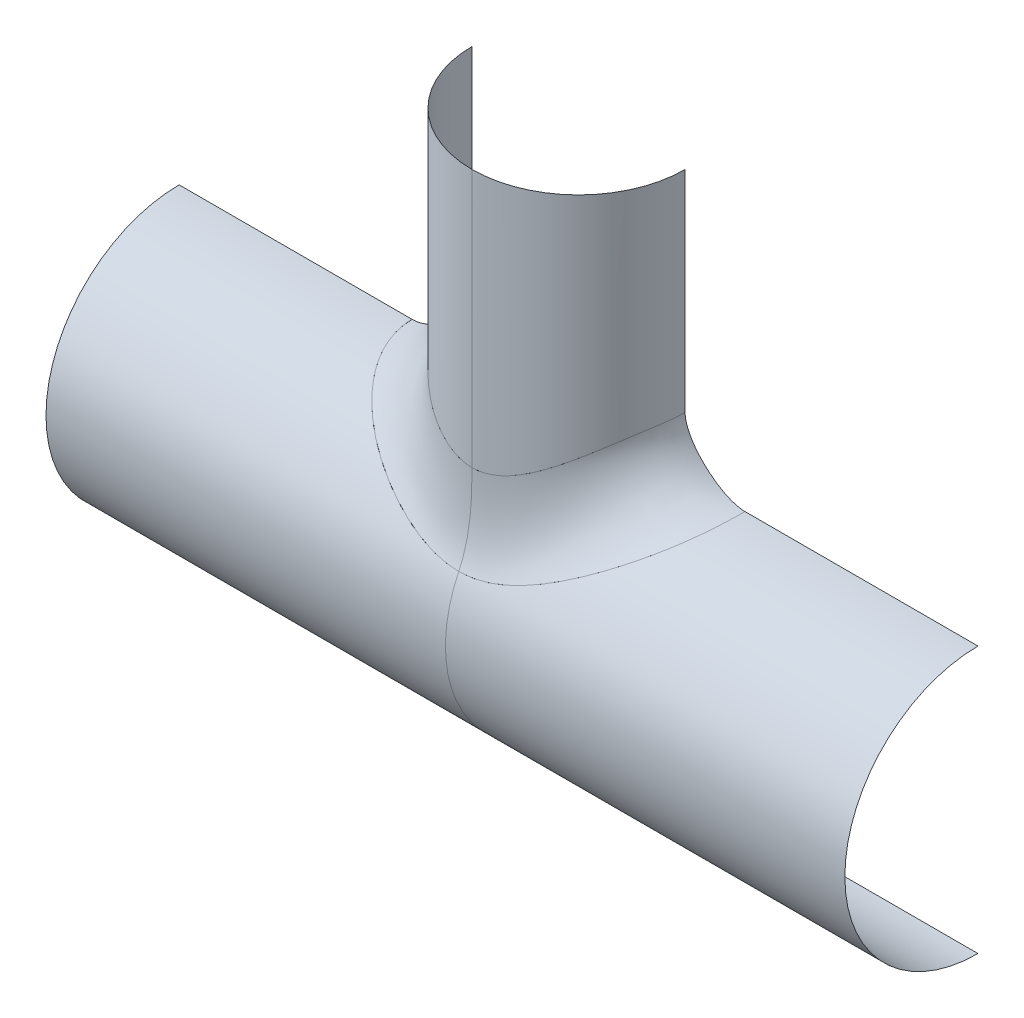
SolidWorks part; units mm, degrees
ref_plane "Vorne" through (0, 0, 0) normal (0, 0, 1) x (1, 0, 0)
ref_plane "Oben" through (0, 0, 0) normal (0, 1, 0) x (1, 0, 0)
ref_plane "Rechts" through (0, 0, 0) normal (1, 0, 0) x (0, 0, -1)
sketch "Skizze1" plane through (0, 0, 0) normal (1, 0, 0) x (0, 0, -1)
  circle A0 centre (0, 0) radius 50
  dimension "D1" = 100
surface "Oberfläche-Linear austragen1" sketch "Skizze1" parameters "D1"=300
sketch "Skizze3" plane through (0, 0, 0) normal (0, 1, 0) x (1, 0, 0)
  circle A0 centre (0, 0) radius 40
  dimension "D1" = 80
surface "Oberfläche-Linear austragen2" sketch "Skizze3" parameters "D1"=300
surface "Oberfläche-Trimmen1"
surface "Oberfläche-Trimmen2"
fillet "Verrundung2" radius 20 4 edges at (-10.3013, 31.7194, -38.6508)
sketch "Skizze4" plane through (0, 0, 0) normal (0, 0, 1) x (1, 0, 0)
  line L0 (-40, 150) -> (-40, 70) construction
  line L1 (54.177, 71) -> (25.702, 71) construction
  line L2 (-25.2896, 71) -> (-54.7104, 71) construction
  line L3 (0, -50) -> (0, 50) construction
  line L5 (40, 70) -> (40, 150) construction
  spline S0 degree 3 poles (-40, 71) (-35, 71) (-0.0691, 35) (35, 71) (40, 71) knots 0 0 0 0 0.500493 1 1 1 1
  dimension "D1" = 53
  dimension "D2" = 71
curve "Kurve1"
sketch "Skizze5" plane through (0, 0, 0) normal (0, 1, 0) x (1, 0, 0)
  line L0 (-60, 0) -> (-150, 0) construction
  line L1 (150, 0) -> (60, 0) construction
  line L2 (0, -50) -> (0, 50) construction
  line L3 (-50, 0) -> (50, 0) construction
  line L4 (-62.5, 0) -> (-62.5, 18.1346) construction
  line L5 (62.5, 0) -> (62.5, 23.2432) construction
  line L6 (0, 0) -> (0, -61.8119) construction
  spline S0 degree 3 poles (-62.5, 0) (-62.5, -28.3333) (0, -61.6667) (62.5, -28.3333) (62.5, 0) knots 0 0 0 0 0.5 1 1 1 1
  dimension "D1" = 45
  dimension "D2" = 125
curve "Kurve2"
other "Fläche löschen3"
surface "Oberfläche-Trimmen3"
surface "Oberfläche-Trimmen4"
sketch "Skizze6" plane through (0, 0, 0) normal (0, 0, 1) x (1, 0, 0)
  line L0 (40, 71) -> (40, 150) construction
  line L1 (40, 63.3847) -> (40, 79.7993) construction
  line L2 (150, 50) -> (62.5, 50) construction
  line L3 (71.2569, 50) -> (53.7199, 50) construction
  spline S0 degree 3 poles (40, 71) (40, 59.3333) (50.8333, 50) (62.5, 50) knots 0 0 0 0 1 1 1 1
sketch "Skizze7" plane through (0, 0, 0) normal (0, 0, 1) x (1, 0, 0)
  line L0 (-62.5, 50) -> (-150, 50) construction
  line L1 (-71.6715, 50) -> (-53.0048, 50) construction
  line L2 (-40, 150) -> (-40, 71) construction
  line L3 (-40, 61.7614) -> (-40, 80.4281) construction
  spline S0 degree 3 poles (-40, 71) (-40, 59.3333) (-50.8333, 50) (-62.5, 50) knots 0 0 0 0 1 1 1 1
surface "Oberfläche-Ausformung2" [suppressed]
sketch "Skizze8" plane through (0, 0, 0) normal (1, 0, 0) x (0, 0, -1)
  line L0 (-40, 53) -> (-40, 150) construction
  arc A1 (-45, 21.7945) -> (0, -50) centre (0, 0) ccw construction
  spline S0 degree 5 poles (-40, 53) (-40, 46.6793) (-40, 40.3586) (-38.6845, 32.6014) (-42.2802, 27.4101) (-45, 21.7945) knots 0 0 0 0 0 0 1 1 1 1 1 1
curve "ZusammengKurve1"
curve "ZusammengKurve2"
surface "Oberfläche-Ausformung4"
surface "Oberfläche-Ausformung5"
surface "Oberfläche-Ausformung3" [suppressed]
